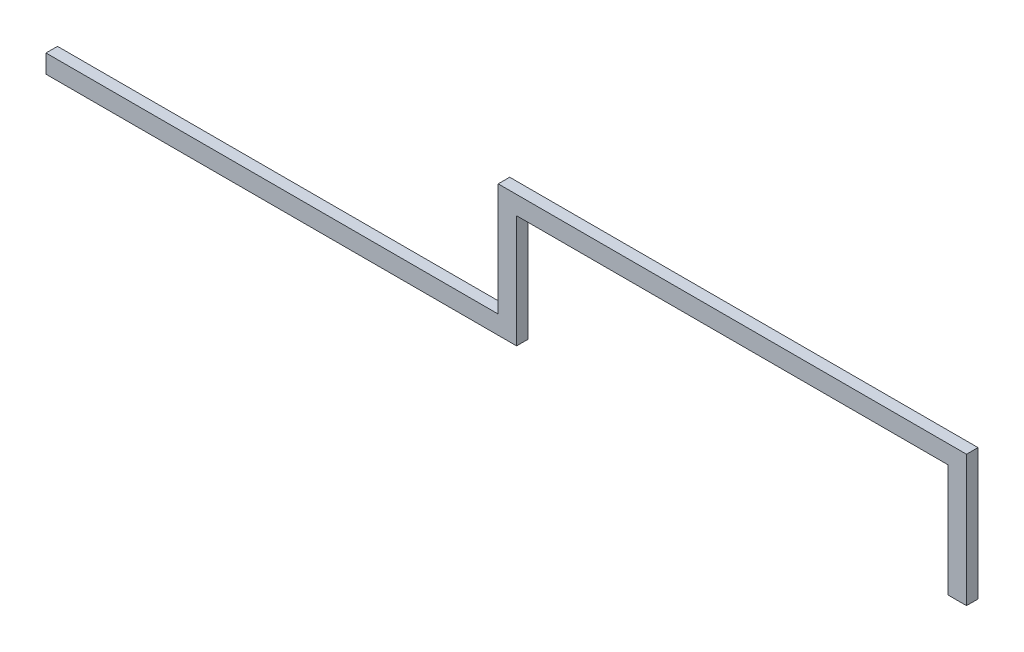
SolidWorks part; units mm, degrees
ref_plane "Ebene vorne" through (0, 0, 0) normal (0, 0, 1) x (1, 0, 0)
ref_plane "Ebene oben" through (0, 0, 0) normal (0, 1, 0) x (1, 0, 0)
ref_plane "Ebene rechts" through (0, 0, 0) normal (1, 0, 0) x (0, 0, -1)
sketch "Skizze1" plane through (0, 0, 0) normal (0, 0, 1) x (1, 0, 0)
  line L1 (-200, 57) -> (200, 57)
  line L2 (-200, 57) -> (-200, 0)
  line L3 (-200, 0) -> (200, 0)
  line L4 (200, 57) -> (200, 0)
  dimension "D1" = 57
  dimension "D2" = 400
extrude "Linear austragen1" add sketch "Skizze1" along normal blind 5
sketch "Skizze2" plane through (0, 0, 5) normal (0, 0, 1) x (1, 0, 0)
  line L0 (200, 57) -> (-200, 57) construction
  line L1 (-200, 57) -> (-3.5042, 57)
  line L2 (-200, 57) -> (-200, 8)
  line L3 (-200, 8) -> (-3.5042, 8)
  line L4 (-3.5042, 57) -> (-3.5042, 8)
  line L5 (-200, 0) -> (200, 0) construction
  line L6 (192, 0) -> (4.4958, 0)
  line L7 (192, 0) -> (192, 49)
  line L8 (192, 49) -> (4.4958, 49)
  line L9 (4.4958, 0) -> (4.4958, 49)
  line L10 (200, 0) -> (200, 57) construction
  dimension "D1" = 8
  dimension "D2" = 8
  dimension "D3" = 8
  dimension "D4" = 8
extrude "Schnitt-Linear austragen1" cut sketch "Skizze2" against normal through all
